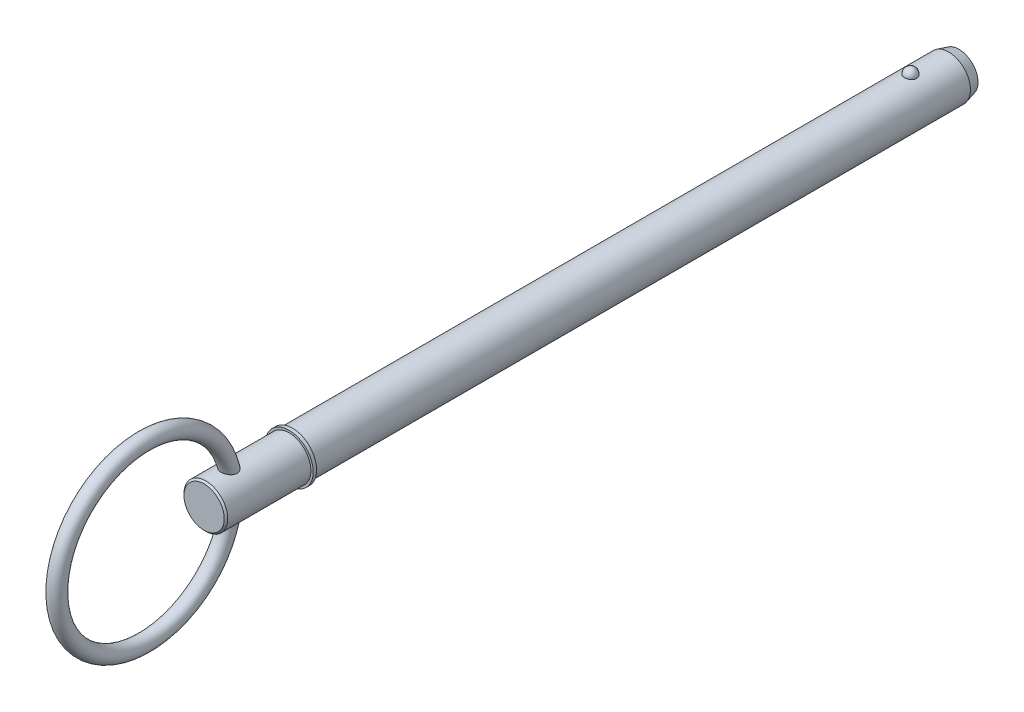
SolidWorks part; units mm, degrees
ref_plane "Front Plane" through (0, 0, 0) normal (0, 0, 1) x (1, 0, 0)
ref_plane "Top Plane" through (0, 0, 0) normal (0, 1, 0) x (1, 0, 0)
ref_plane "Right Plane" through (0, 0, 0) normal (1, 0, 0) x (0, 0, -1)
sketch "Sketch2" plane through (0, 0, 0) normal (0, 0, 1) x (1, 0, 0)
  circle A0 centre (0, 0) radius 6.35
  point P3 (0, 6.35)
  dimension "D1" = 12.7
extrude "Boss-Extrude1" add sketch "Sketch2" along normal blind 177.8
sketch "Sketch3" plane through (0, 0, 0) normal (0, 0, -1) x (-1, 0, 0)
  circle A0 centre (0, 0) radius 6.35
  dimension "D1" = 12.7
extrude "Boss-Extrude2" add sketch "Sketch3" along normal blind 15.88
chamfer "Chamfer1" distance 3 angle 15 1 edges at (-6.35, 0, -15.88)
sketch "Sketch18" plane through (0, 0, 0) normal (1, 0, 0) x (0, 0, -1)
  line L0 (12.88, 6.35) -> (-177.8, 6.35) construction
  line L1 (1.78, 8.13) -> (1.78, 4.57)
  line L2 (-177.8, -6.35) -> (12.88, -6.35) construction
  arc A0 (1.78, 8.13) -> (1.78, 4.57) centre (1.78, 6.35) ccw
  point P4 (0, 6.35)
  dimension "D1" = 14.48
revolve "Revolve1" add sketch "Sketch18" angle 360 about L1
sketch "Sketch19" plane through (0, 0, 0) normal (1, 0, 0) x (0, 0, -1)
  line L0 (-33.7288, 0) -> (-46.4542, 0) construction
sketch "Sketch20" plane through (0, 0, 0) normal (1, 0, 0) x (0, 0, -1)
  line L0 (-177.8, 0) -> (-177.8, 7)
  line L1 (-177.8, 6.35) -> (-177.8, -6.35) construction
  line L2 (-177.8, 7) -> (-178.8, 7)
  line L3 (-178.8, 7) -> (-178.8, 0)
  line L4 (-33.7288, 0) -> (-46.4542, 0) construction
  line L5 (-178.8, 0) -> (-177.8, 0)
  dimension "D1" = 7
  dimension "D2" = 1
revolve "Revolve2" add sketch "Sketch20" angle 360 about L0
sketch "Sketch21" plane through (0, 0, 177.8) normal (0, 0, -1) x (-1, 0, 0)
  circle A0 centre (0, 0) radius 6.35
  dimension "D1" = 12.7
extrude "Boss-Extrude3" add sketch "Sketch21" against normal blind 25.7
chamfer "Chamfer2" distance 0.5 angle 45 1 edges at (-6.35, 0, 203.5)
sketch "Sketch23" plane through (0, 0, 0) normal (1, 0, 0) x (0, 0, -1)
  line L0 (-203.5, 5.85) -> (-203.5, -5.85) construction
  circle A0 centre (-220.9, 0) radius 25.4
  point P2 (-195.5, 0)
  dimension "D1" = 50.8
  dimension "D2" = 8
sketch "Sketch24" plane through (0, 0, 0) normal (0, 1, 0) x (1, 0, 0)
  circle A0 centre (0, -195.5) radius 2.25
  dimension "D1" = 4.5
sweep "Sweep1" add profiles "Sketch24" path "Sketch23"
